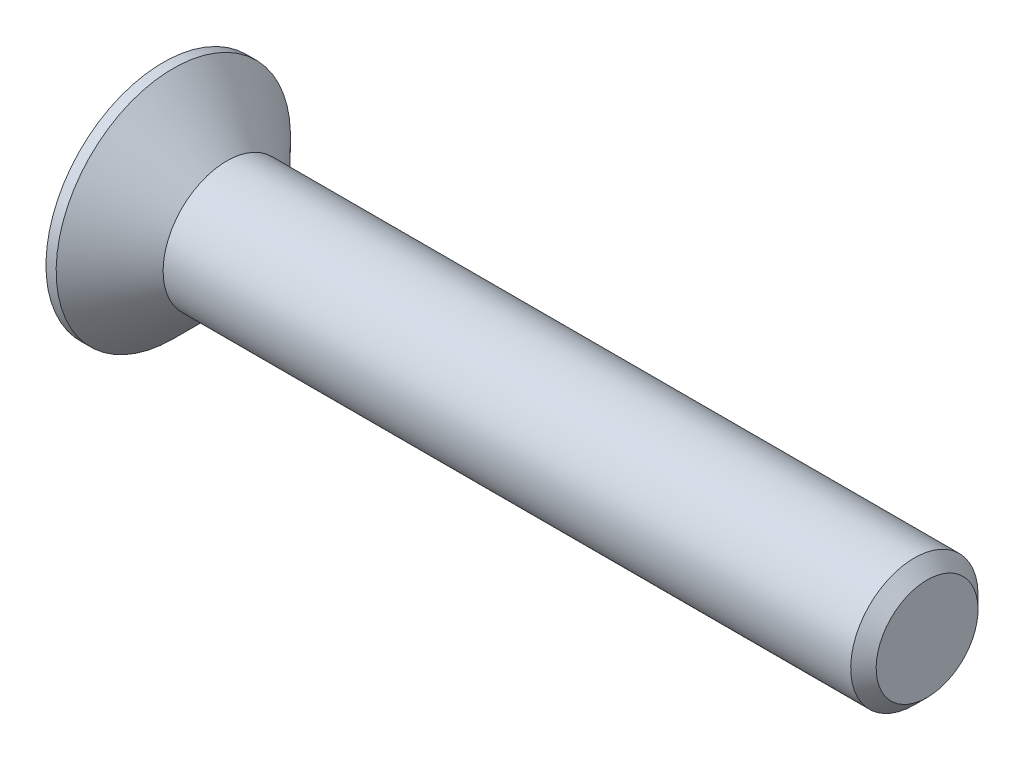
SolidWorks part; units mm, degrees
ref_plane "Front Plane" through (0, 0, 0) normal (0, 0, 1) x (1, 0, 0)
ref_plane "Top Plane" through (0, 0, 0) normal (0, 1, 0) x (1, 0, 0)
ref_plane "Right Plane" through (0, 0, 0) normal (1, 0, 0) x (0, 0, -1)
sketch "Sketch1" plane through (0, 0, 0) normal (0, 0, 1) x (1, 0, 0)
  line L1 (-2.5, 4.6) -> (-2.5, 0)
  line L2 (-2.5, 0) -> (27.5, 0)
  line L3 (27.5, 0) -> (27.5, 2.5)
  line L4 (27.5, 2.5) -> (0, 2.5)
  line L5 (-2.5, 4.6) -> (-2.1, 4.6)
  line L6 (-2.1, 4.6) -> (0, 2.5)
  dimension "D1" = 2.5
  dimension "D2" = 45
  dimension "D3" = 2.5
  dimension "D4" = 30
  dimension "D5" = 4.6
revolve "Revolve1" add sketch "Sketch1" angle 360 about L2
chamfer "Chamfer1" distance 0.5 angle 45 1 edges at (27.5, -2.5, 0)
sketch "Sketch2" plane through (-2.5, 0, 0) normal (-1, 0, 0) x (0, 0, 1)
  line L0 (-0.575, 2.3) -> (0.575, 2.3)
  line L1 (0.575, 2.3) -> (0.575, 0.575)
  line L2 (0.575, 0.575) -> (2.3, 0.575)
  line L3 (2.3, 0.575) -> (2.3, -0.575)
  line L4 (2.3, -0.575) -> (0.575, -0.575)
  line L5 (0.575, -0.575) -> (0.575, -2.3)
  line L6 (0.575, -2.3) -> (-0.575, -2.3)
  line L7 (-0.575, -2.3) -> (-0.575, -0.575)
  line L8 (-0.575, -0.575) -> (-2.3, -0.575)
  line L9 (-2.3, -0.575) -> (-2.3, 0.575)
  line L10 (-2.3, 0.575) -> (-0.575, 0.575)
  line L11 (-0.575, 0.575) -> (-0.575, 2.3)
  point P2 (0, 2.3)
  point P14 (0, -2.3)
  point P15 (2.3, 0)
  point P16 (-2.3, 0)
  dimension "D1" = 4.6
  dimension "D2" = 1.15
extrude "Cut-Extrude1" cut sketch "Sketch2" against normal blind 2.1
